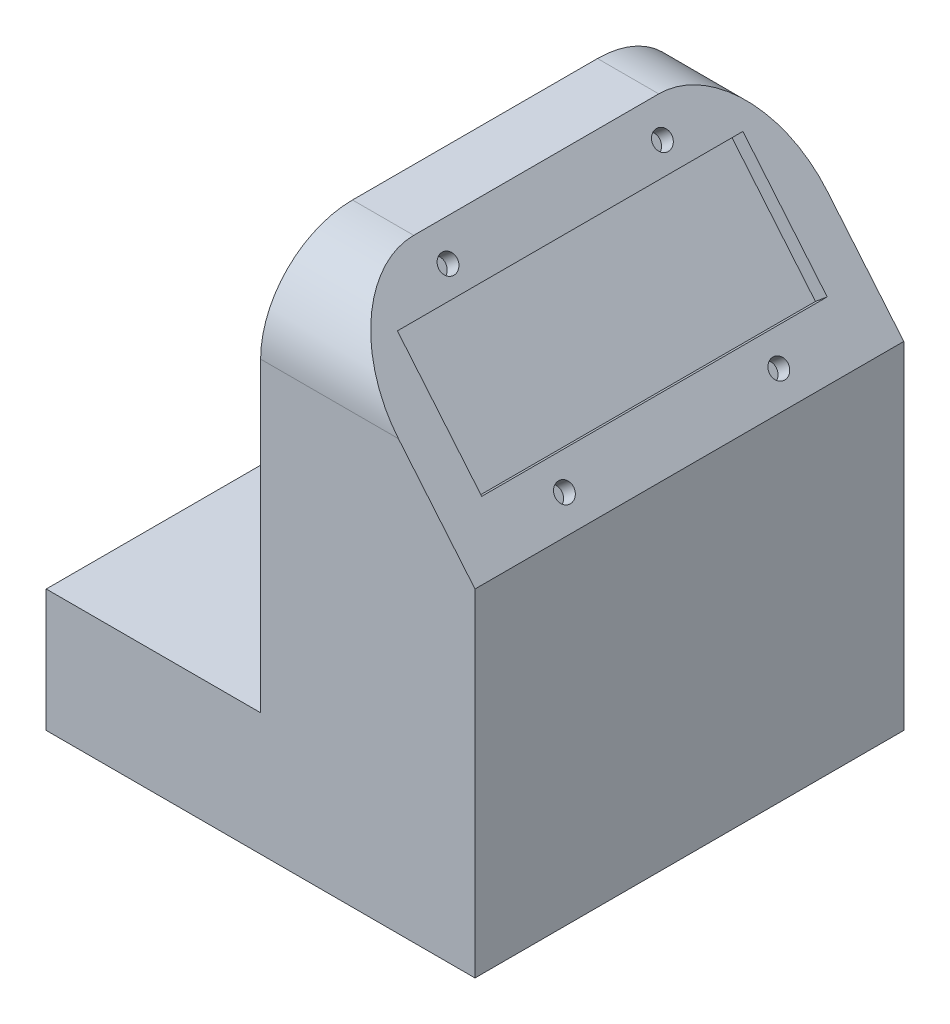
SolidWorks part; units mm, degrees
ref_plane "Front Plane" through (0, 0, 0) normal (0, 0, 1) x (1, 0, 0)
ref_plane "Top Plane" through (0, 0, 0) normal (0, 1, 0) x (1, 0, 0)
ref_plane "Right Plane" through (0, 0, 0) normal (1, 0, 0) x (0, 0, -1)
sketch "Sketch1" plane through (0, 0, 0) normal (0, 1, 0) x (1, 0, 0)
  line L1 (0, 0) -> (88.9, 0)
  line L2 (0, 0) -> (0, 88.9)
  line L3 (0, 88.9) -> (88.9, 88.9)
  line L4 (88.9, 0) -> (88.9, 88.9)
  dimension "D1" = 88.9
  dimension "D2" = 88.9
extrude "Boss-Extrude1" add sketch "Sketch1" along normal blind 25.4
sketch "Sketch2" plane through (0, 0, 0) normal (0, 0, 1) x (1, 0, 0)
  line L0 (88.9, 25.4) -> (88.9, 69.85)
  line L1 (88.9, 69.85) -> (57.15, 107.95)
  line L2 (57.15, 107.95) -> (44.45, 107.95)
  line L3 (44.45, 107.95) -> (44.45, 25.4)
  line L4 (0, 25.4) -> (88.9, 25.4) construction
  line L5 (44.45, 25.4) -> (88.9, 25.4)
  dimension "D1" = 44.45
  dimension "D2" = 44.45
  dimension "D3" = 12.7
  dimension "D4" = 82.55
extrude "Boss-Extrude2" add sketch "Sketch2" against normal up to surface (88.9 mm away)
sketch "Sketch3" plane through (86.818, 72.3484, 0) normal (0.7682, 0.6402, 0) x (0, 0, -1)
  line L0 (22.225, 40.2013) -> (66.675, 40.2013) construction
  line L1 (8.636, 35.3665) -> (80.264, 35.3665)
  line L2 (8.636, 35.3665) -> (8.636, 8.0615)
  line L3 (8.636, 8.0615) -> (80.264, 8.0615)
  line L4 (80.264, 35.3665) -> (80.264, 8.0615)
  line L5 (44.45, 8.0615) -> (44.45, 40.2013) construction
  line L6 (88.9, -3.2521) -> (0, -3.2521) construction
  line L7 (88.9, -3.2521) -> (0, -3.2521) construction
  line L8 (44.45, -3.2521) -> (44.45, -22.6548) construction
  circle A0 centre (22.225, 40.2013) radius 1.905
  circle A1 centre (22.225, 2.4956) radius 1.905
  circle A2 centre (66.675, 40.2013) radius 1.905
  circle A3 centre (66.675, 2.4956) radius 1.905
  dimension "D3" = 3.81
  dimension "D4" = 3.81
  dimension "D5" = 3.81
  dimension "D6" = 3.81
  dimension "D1" = 71.628
  dimension "D2" = 27.305
  dimension "D7" = 44.45
extrude "Cut-Extrude1" cut sketch "Sketch3" against normal blind 3.175
sketch "Sketch4" plane through (88.9, 0, 0) normal (1, 0, 0) x (0, 0, -1)
  line L0 (88.9, 25.4) -> (88.9, 107.95) construction
  line L1 (88.9, 107.95) -> (0, 107.95) construction
  line L2 (0, 107.95) -> (0, 25.4) construction
  line L3 (88.9, 25.4) -> (88.9, 88.9)
  line L4 (69.85, 107.95) -> (19.05, 107.95)
  line L5 (0, 88.9) -> (0, 25.4)
  line L6 (0, 25.4) -> (-34.4948, 34.925)
  line L7 (-34.4948, 34.925) -> (-19.6432, 154.0829)
  line L8 (-19.6432, 154.0829) -> (144.2864, 131.6276)
  line L9 (144.2864, 131.6276) -> (128.2386, 34.925)
  line L10 (128.2386, 34.925) -> (88.9, 25.4)
  arc A0 (69.85, 107.95) -> (88.9, 88.9) centre (69.85, 88.9) cw
  arc A1 (19.05, 107.95) -> (0, 88.9) centre (19.05, 88.9) ccw
  dimension "D1" = 19.05
  dimension "D2" = 82.55
extrude "Cut-Extrude2" cut sketch "Sketch4" against normal up to surface (44.45 mm away)
